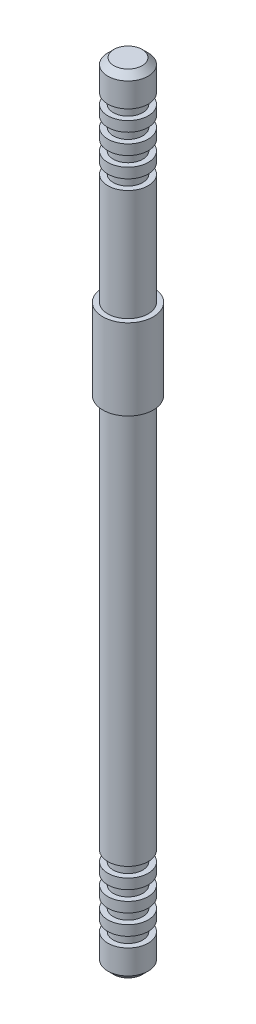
SolidWorks part; units mm, degrees
ref_plane "Face" through (0, 0, 0) normal (0, 0, 1) x (1, 0, 0)
ref_plane "Dessus" through (0, 0, 0) normal (0, 1, 0) x (1, 0, 0)
ref_plane "Droite" through (0, 0, 0) normal (1, 0, 0) x (0, 0, -1)
sketch "Esquisse1" plane through (0, 0, 0) normal (0, 0, 1) x (1, 0, 0)
  line L0 (-26.3726, -54.79) -> (-26.3726, -56.29)
  line L1 (-26.3726, -56.29) -> (-26.1026, -56.29)
  line L2 (-26.1026, -56.29) -> (-26.1026, -56.79)
  line L3 (-26.1026, -56.79) -> (-26.3726, -56.79)
  line L4 (-26.3726, -56.79) -> (-26.3726, -57.29)
  line L5 (-26.3726, -57.29) -> (-26.1026, -57.29)
  line L6 (-26.1026, -57.29) -> (-26.1026, -57.79)
  line L7 (-26.1026, -57.79) -> (-26.3726, -57.79)
  line L8 (-26.3726, -57.79) -> (-26.3726, -58.29)
  line L9 (-26.3726, -58.29) -> (-26.1026, -58.29)
  line L10 (-26.1026, -58.29) -> (-26.1026, -58.79)
  line L11 (-26.1026, -58.79) -> (-26.3726, -58.79)
  line L12 (-26.3726, -58.79) -> (-26.3726, -59.29)
  line L13 (-26.3726, -59.29) -> (-26.1026, -59.29)
  line L14 (-26.1026, -59.29) -> (-26.1026, -59.79)
  line L15 (-26.1026, -59.79) -> (-26.3726, -59.79)
  line L16 (-26.3726, -59.79) -> (-26.3726, -65.29)
  line L17 (-26.3726, -88.79) -> (-26.1026, -88.79)
  line L18 (-26.1026, -88.79) -> (-26.1026, -89.29)
  line L19 (-26.1026, -89.29) -> (-26.3726, -89.29)
  line L20 (-26.3726, -89.29) -> (-26.3726, -89.79)
  line L21 (-26.3726, -89.79) -> (-26.1026, -89.79)
  line L22 (-26.1026, -89.79) -> (-26.1026, -90.29)
  line L23 (-26.1026, -90.29) -> (-26.3726, -90.29)
  line L24 (-26.3726, -90.29) -> (-26.3726, -90.79)
  line L25 (-26.3726, -90.79) -> (-26.1026, -90.79)
  line L26 (-26.1026, -90.79) -> (-26.1026, -91.29)
  line L27 (-26.1026, -91.29) -> (-26.3726, -91.29)
  line L28 (-26.3726, -91.29) -> (-26.3726, -91.79)
  line L29 (-26.1026, -91.79) -> (-26.3726, -91.79)
  line L30 (-26.1026, -91.79) -> (-26.1026, -92.29)
  line L31 (-26.3726, -92.29) -> (-26.3726, -93.79)
  line L32 (-26.3726, -93.79) -> (-25.3726, -93.79)
  line L33 (-25.3726, -93.79) -> (-25.3726, -54.79)
  line L34 (-25.3726, -54.79) -> (-26.3726, -54.79)
  line L35 (-26.1026, -92.29) -> (-26.3726, -92.29)
  line L36 (-25.3726, -54.79) -> (-25.3726, 112.5259) construction
  line L37 (-26.3726, -69.29) -> (-26.6226, -69.29)
  line L38 (-26.6226, -69.29) -> (-26.6226, -65.29)
  line L39 (-26.6226, -65.29) -> (-26.3726, -65.29)
  line L40 (-26.3726, -69.29) -> (-26.3726, -88.79)
  dimension "D2" = 1.46
  dimension "D3" = 2
  dimension "D4" = 1.5
  dimension "D5" = 0.5
  dimension "D6" = 0.5
  dimension "D7" = 0.5
  dimension "D8" = 0.5
  dimension "D9" = 0.5
  dimension "D10" = 0.5
  dimension "D11" = 0.5
  dimension "D12" = 0.5
  dimension "D13" = 0.5
  dimension "D14" = 0.5
  dimension "D15" = 0.5
  dimension "D16" = 0.5
  dimension "D17" = 0.5
  dimension "D18" = 0.5
  dimension "D19" = 1.5
  dimension "D20" = 39
  dimension "D21" = 24.5
  dimension "D22" = 4
  dimension "D23" = 2.5
revolve "Révolution1" add sketch "Esquisse1" angle 360 about L36
chamfer "Chanfrein1" distance 0.3 angle 45 2 edges at (-25.3726, -54.79, -1) (-25.3726, -93.79, -1)
